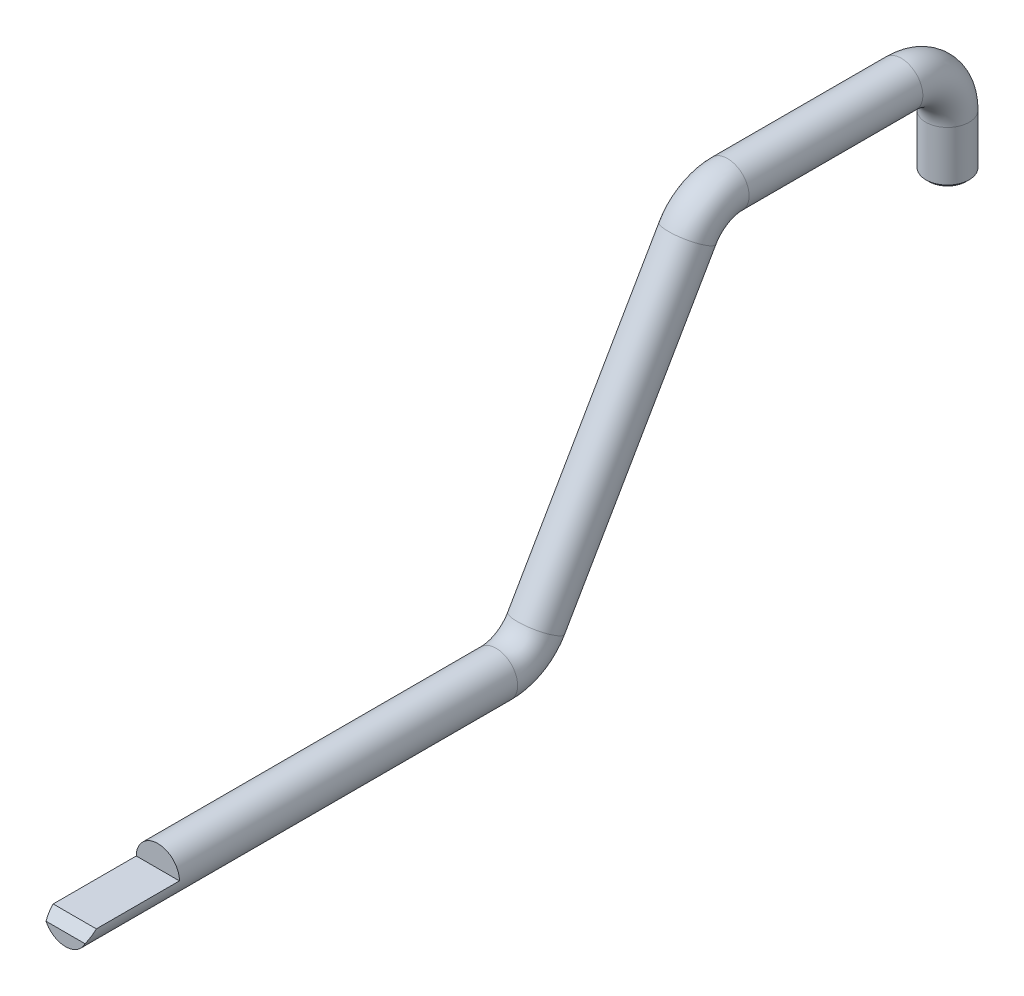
SolidWorks part; units mm, degrees
ref_plane "Front Plane" through (0, 0, 0) normal (0, 0, 1) x (1, 0, 0)
ref_plane "Top Plane" through (0, 0, 0) normal (0, 1, 0) x (1, 0, 0)
ref_plane "Right Plane" through (0, 0, 0) normal (1, 0, 0) x (0, 0, -1)
body saved out of another part "Stock-Piranha-h0400-4341-1"
